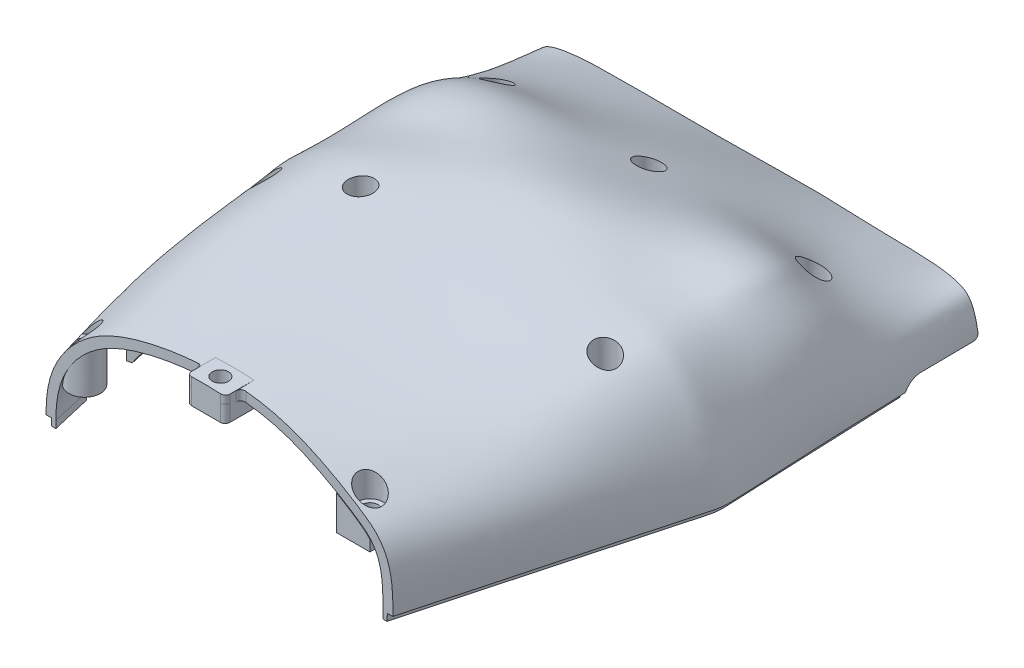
SolidWorks part; units mm, degrees
ref_plane "Front Plane" through (0, 0, 0) normal (0, 0, 1) x (1, 0, 0)
ref_plane "Top Plane" through (0, 0, 0) normal (0, 1, 0) x (1, 0, 0)
ref_plane "Right Plane" through (0, 0, 0) normal (1, 0, 0) x (0, 0, -1)
body saved out of another part "-Telapak 2022-1"
